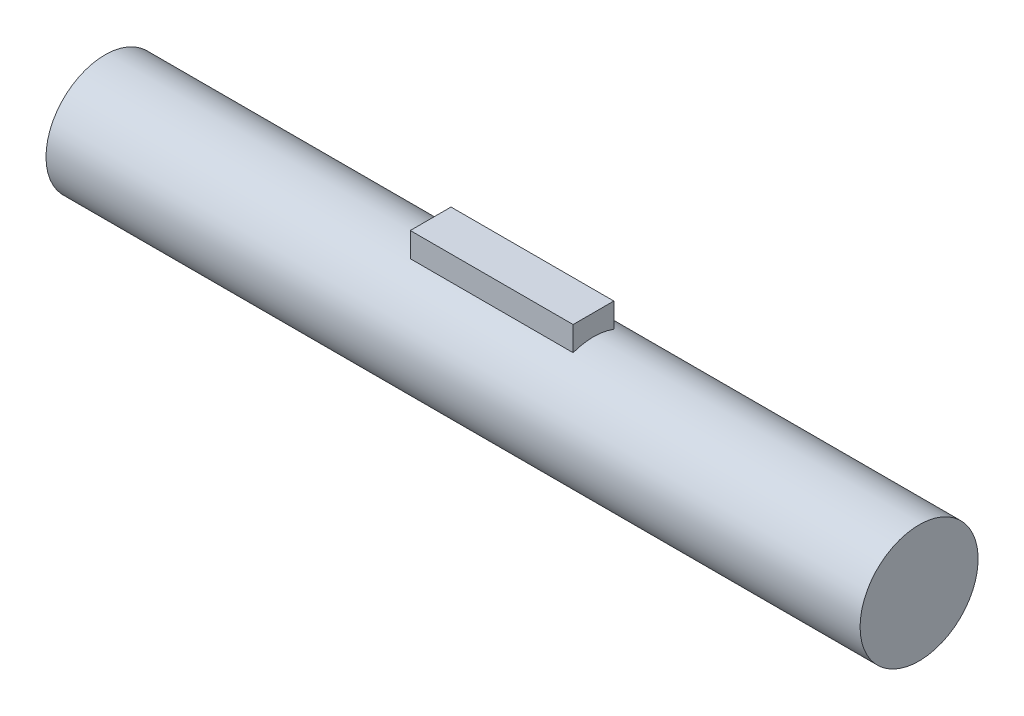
SolidWorks part; units mm, degrees
ref_plane "前视基准面" through (0, 0, 0) normal (0, 0, 1) x (1, 0, 0)
ref_plane "上视基准面" through (0, 0, 0) normal (0, 1, 0) x (1, 0, 0)
ref_plane "右视基准面" through (0, 0, 0) normal (1, 0, 0) x (0, 0, -1)
sketch "草图1" plane through (0, 0, 0) normal (1, 0, 0) x (0, 0, -1)
  line L0 (0, 2.3287) -> (0, -1.9132) construction
  line L1 (0.5, 1.9611) -> (-0.5, 1.9611)
  line L2 (-0.5, 1.9611) -> (-0.5, 1.3611)
  line L3 (0.5, 1.9611) -> (0.5, 1.3611)
  arc A0 (-0.5, 1.3611) -> (0.5, 1.3611) centre (0, 0) ccw
  point P10 (0, 1.9611)
  dimension "D1" = 2.9
  dimension "D2" = 1
  dimension "D3" = 0.6
extrude "凸台-拉伸1" add sketch "草图1" along normal mid plane 4
sketch "草图2" plane through (-2, 0, 0) normal (-1, 0, 0) x (0, 0, 1)
  circle A0 centre (0, 0) radius 1.45
  arc A1 (-0.5, 1.3611) -> (0.5, 1.3611) centre (0, 0) ccw construction
extrude "凸台-拉伸2" add sketch "草图2" along normal blind 8
mirror "镜向1" about plane through (0, 0, 0) normal (1, 0, 0) of "凸台-拉伸2"
